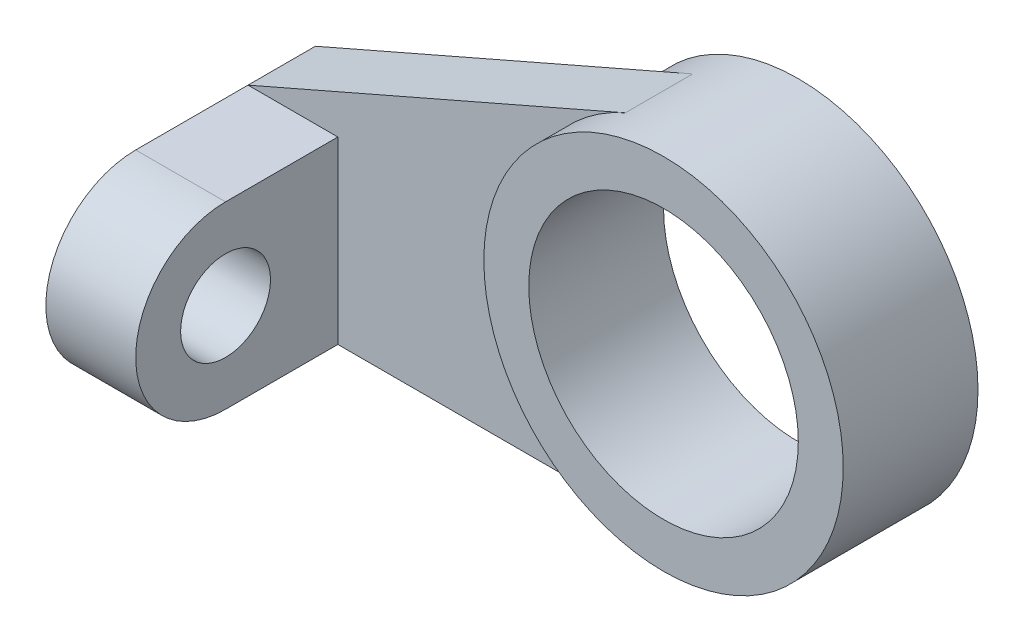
SolidWorks part; units mm, degrees
ref_plane "Front Plane" through (0, 0, 0) normal (0, 0, 1) x (1, 0, 0)
ref_plane "Top Plane" through (0, 0, 0) normal (0, 1, 0) x (1, 0, 0)
ref_plane "Right Plane" through (0, 0, 0) normal (1, 0, 0) x (0, 0, -1)
sketch "Sketch1" plane through (0, 0, 0) normal (0, 0, 1) x (1, 0, 0)
  circle A0 centre (0, 0) radius 50.8
  dimension "D1" = 101.6
extrude "Extrude-Thin1" add sketch "Sketch1" along normal mid plane 38.1 thin
sketch "Sketch3" plane through (0, 0, 0) normal (0, 0, 1) x (1, 0, 0)
  line L0 (0, -50.8) -> (-127, -50.8)
  line L1 (-127, -50.8) -> (-127, 0)
  line L2 (-127, 0) -> (-20.32, 46.559)
  circle A0 centre (0, 0) radius 50.8 construction
  arc A1 (-20.32, 46.559) -> (0, -50.8) centre (0, 0) ccw
  point P4 (-127, -50.8)
  point P8 (0, -50.8)
  point P9 (-19.8991, 46.7404)
  point P10 (0, 0)
  dimension "D1" = 127
  dimension "D2" = 50.8
extrude "Boss-Extrude1" add sketch "Sketch3" along normal mid plane 19.05
sketch "Sketch4" plane through (-127, 0, 0) normal (-1, 0, 0) x (0, 0, 1)
  line L0 (9.525, -50.8) -> (-9.525, -50.8) construction
  line L1 (-9.525, 0) -> (-9.525, -50.8) construction
  line L2 (9.525, 0) -> (41.275, 0)
  line L3 (9.525, 0) -> (9.525, -50.8)
  line L4 (9.525, -50.8) -> (41.275, -50.8)
  circle A0 centre (41.275, -25.4) radius 12.7
  arc A1 (41.275, -50.8) -> (41.275, 0) centre (41.275, -25.4) ccw
  point P2 (26.4345, -4.7864)
  dimension "D2" = 25.4
  dimension "D3" = 50.8
  dimension "D1" = 50.8
extrude "Boss-Extrude2" add sketch "Sketch4" against normal blind 25.4
